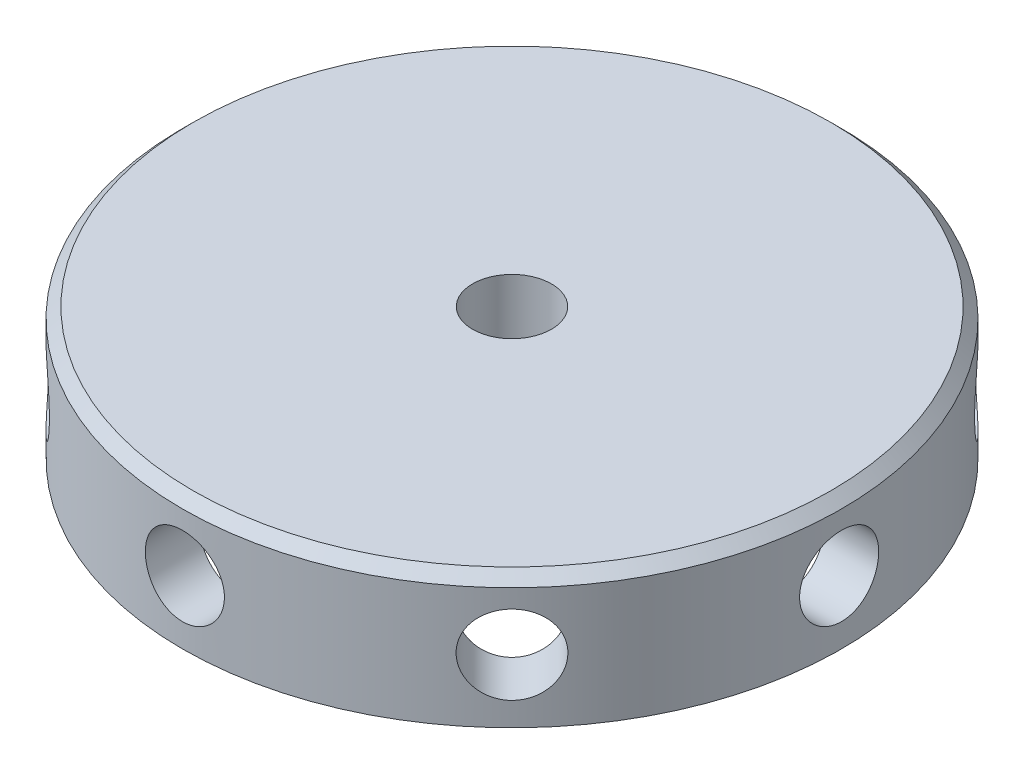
SolidWorks part; units mm, degrees
ref_plane "Front Plane" through (0, 0, 0) normal (0, 0, 1) x (1, 0, 0)
ref_plane "Top Plane" through (0, 0, 0) normal (0, 1, 0) x (1, 0, 0)
ref_plane "Right Plane" through (0, 0, 0) normal (1, 0, 0) x (0, 0, -1)
sketch "Sketch2" plane through (0, 0, 0) normal (0, 1, 0) x (1, 0, 0)
  circle A0 centre (0, 0) radius 15.875
  dimension "D1" = 31.75
extrude "Boss-Extrude2" add sketch "Sketch2" along normal blind 6.35
chamfer "Chamfer1" distance 0.508 angle 45 1 edges at (0, 6.35, 15.875)
sketch "Sketch3" plane through (0, 0, 0) normal (0, -1, 0) x (1, 0, 0)
  circle A1 centre (0, 0) radius 3.81
  circle A2 centre (0, 0) radius 13.335
  circle A3 centre (0, 0) radius 13.335
  dimension "D2" = 7.62
  dimension "D1" = 2.54
extrude "Cut-Extrude1" cut sketch "Sketch3" against normal blind 5.08
sketch "Sketch9" plane through (0, 6.35, 0) normal (0, 1, 0) x (1, 0, 0)
  point P0 (0, 0)
hole_wizard "#6 Clearance Hole1" positions "Sketch9" profile "Sketch10" hole size "#6" standard "ANSI Inch"
sketch "Sketch10" plane through (0, 6.35, 0) normal (1, 0, 0) x (0, 0, 1)
  line L0 (0, 0) -> (0, 10.5388)
  line L1 (0, 10.5388) -> (1.8986, 9.398)
  line L2 (1.8986, 9.398) -> (1.8986, 0)
  line L5 (1.8986, 0) -> (0, 0)
  line L10 (0, 10.5388) -> (-1.8987, 9.398) construction
  line L11 (0, -6.35) -> (0, 107.95) construction
  dimension "Hole Dia." = 3.7973
  dimension "Hole Depth" = 9.398
  dimension "Drill Angle" = 118
ref_plane "Plane1" through (0, 0, 15.875) normal (0, 0, 1) x (1, 0, 0)
sketch "Sketch6" plane through (0, 0, 15.875) normal (0, 0, 1) x (1, 0, 0)
  line L0 (0, 0) -> (0, 9.3972) construction
  line L1 (-13.335, 5.08) -> (13.335, 5.08) construction
  circle A0 centre (0, 3.048) radius 1.905
  dimension "D1" = 3.81
  dimension "D2" = 2.032
extrude "Cut-Extrude3" cut sketch "Sketch6" against normal blind 3.81
pattern_circular "CirPattern1" count 8 over 360 about axis through (0, 0, 0) along (0, 1, 0) of "Cut-Extrude3"
